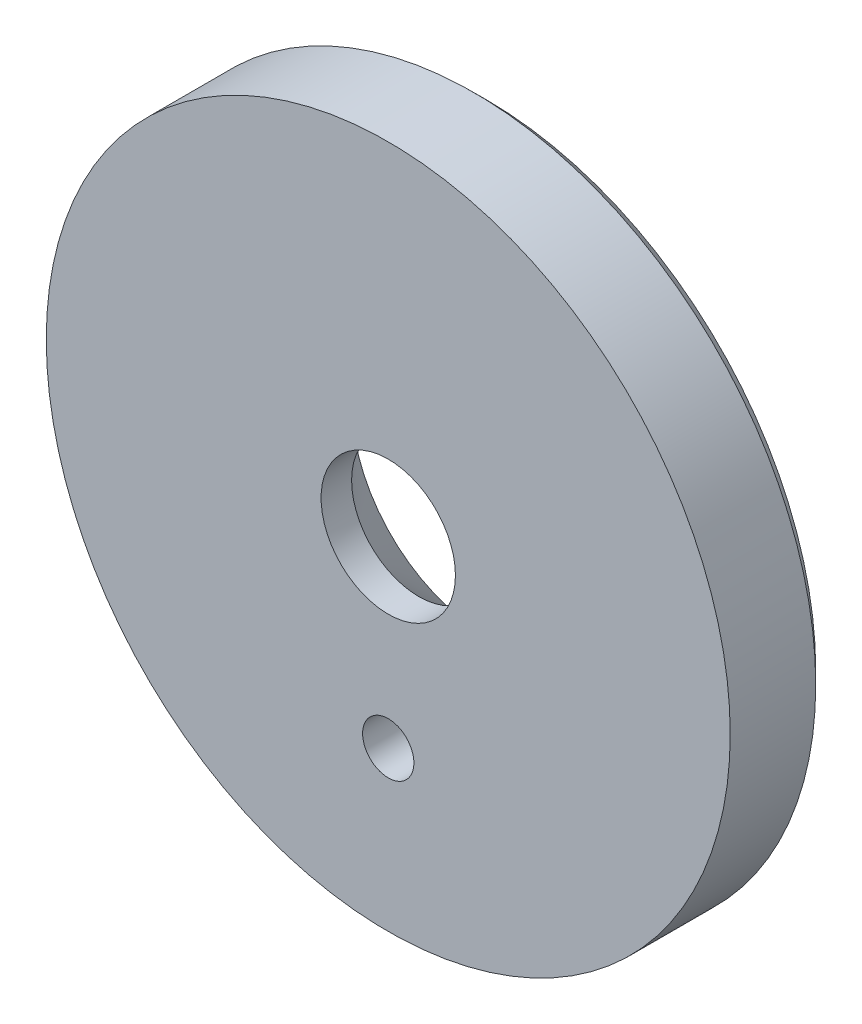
SolidWorks part; units mm, degrees
ref_plane "Front" through (0, 0, 0) normal (0, 0, 1) x (1, 0, 0)
ref_plane "Top" through (0, 0, 0) normal (0, 1, 0) x (1, 0, 0)
ref_plane "Right" through (0, 0, 0) normal (1, 0, 0) x (0, 0, -1)
other "Configuration Table"
sketch "Sketch1" plane through (0, 0, 0) normal (0, 0, 1) x (1, 0, 0)
  circle A0 centre (0, 0) radius 14
  circle A1 centre (0, 0) radius 2.75
  dimension "D0" = 28
  dimension "d" = 5.5
extrude "Base-Extrude" add sketch "Sketch1" against normal blind 4
sketch "Sketch2" plane through (0, 0, 0) normal (0, 1, 0) x (1, 0, 0)
  line L0 (-5.5, 4) -> (-2.75, 4)
  line L2 (-2.75, 4) -> (-2.75, 1.25)
  line L3 (-2.75, 1.25) -> (-5.5, 4)
  line L5 (0, 8.4656) -> (0, -7.9977) construction
  line L6 (-2.75, 4) -> (-2.75, 0) construction
  line L7 (14, 4) -> (-14, 4) construction
  dimension "D1" = 11
  dimension "a" = 45
revolve "Cut-Revolve1" cut sketch "Sketch2" angle 360 about L5
chamfer "Chamfer1" distance 0.5 angle 45 1 edges at (14, 0, -4)
sketch "Sketch3" plane through (-5.3213, -16.4716, -4) normal (0, 0, -1) x (-1, 0, 0)
  circle A0 centre (-5.3213, 8.9716) radius 1.05
  dimension "d1" = 2.1
  dimension "L" = 7.5
extrude "Hole-Exscind" cut sketch "Sketch3" against normal through all
